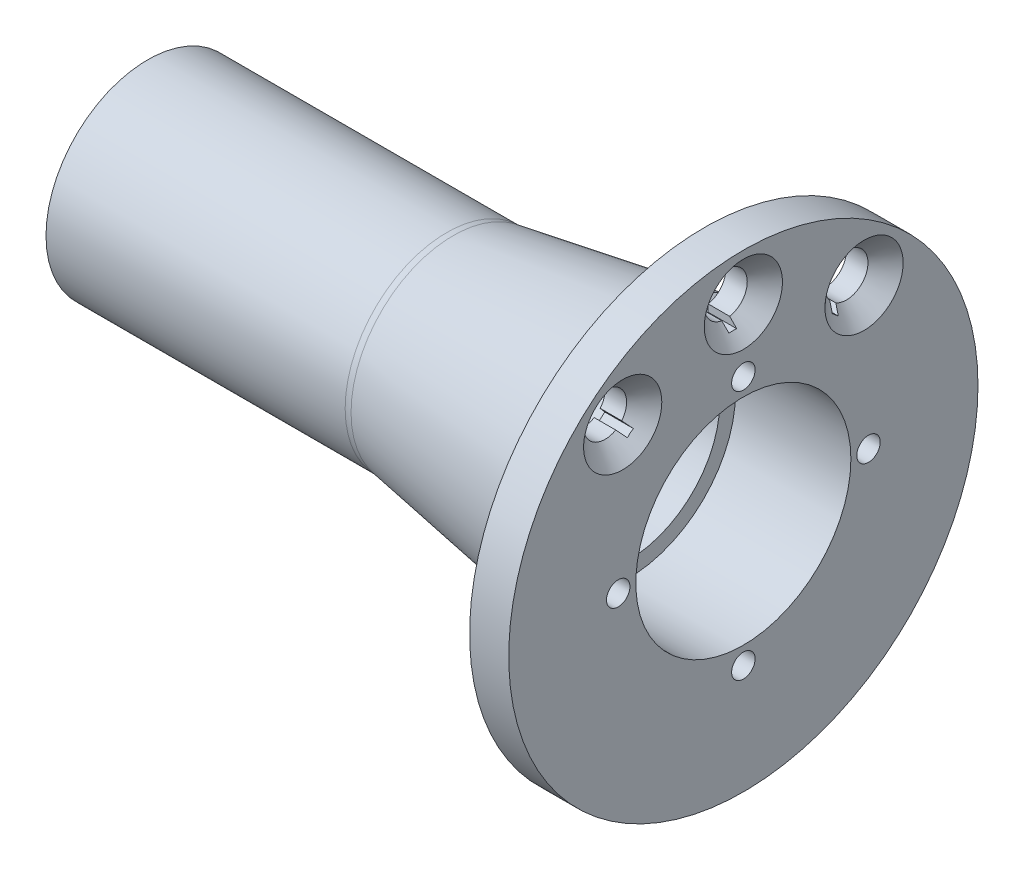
SolidWorks part; units mm, degrees
ref_plane "Face" through (0, 0, 0) normal (0, 0, 1) x (1, 0, 0)
ref_plane "Dessus" through (0, 0, 0) normal (0, 1, 0) x (1, 0, 0)
ref_plane "Droite" through (0, 0, 0) normal (1, 0, 0) x (0, 0, -1)
sketch "Esquisse1" plane through (0, 0, 0) normal (0, 0, 1) x (1, 0, 0)
  line L0 (0, 0) -> (-175.4745, 0) construction
  line L1 (0, 0) -> (0, 60)
  line L2 (0, 60) -> (-10, 60)
  line L3 (-10, 60) -> (-10, 36)
  line L4 (-10, 36) -> (-21, 36)
  line L5 (-21, 36) -> (-21, 35)
  line L6 (-21, 35) -> (-75, 26)
  line L7 (-75, 26) -> (-152.3229, 26)
  line L8 (-152.3229, 26) -> (-152.3229, 0)
  line L9 (-152.3229, 0) -> (0, 0)
  dimension "D1" = 60
  dimension "D2" = 10
  dimension "D3" = 36
  dimension "D4" = 11
  dimension "D5" = 1
  dimension "D6" = 26
  dimension "D7" = 54
revolve "Révolution3" add sketch "Esquisse1" angle 360 about L0
sketch "Esquisse2" plane through (0, 0, 0) normal (0, 0, 1) x (1, 0, 0)
  line L0 (0, 0) -> (0, 27.5)
  line L1 (0, -60) -> (0, 60) construction
  line L2 (0, 27.5) -> (-29.5, 27.5)
  line L3 (-29.5, 27.5) -> (-29.5, 23.5)
  line L4 (-29.5, 23.5) -> (-75, 21)
  line L5 (-75, 21) -> (-152.3229, 21)
  line L6 (-152.3229, 26) -> (-152.3229, -26) construction
  line L7 (-75, 26) -> (-75, -26) construction
  line L8 (0, 0) -> (-159.6226, 0) construction
  line L9 (0, 0) -> (-152.3229, 0)
  line L10 (-152.3229, 0) -> (-152.3229, 21)
  dimension "D1" = 27.5
  dimension "D2" = 29.5
  dimension "D3" = 4
  dimension "D4" = 21
revolve "Enlèvement de matière-Révolution1" cut sketch "Esquisse2" angle 360 about L8
hole_wizard "Trou taraudé M6x1.03" positions "Esquisse4" profile "Esquisse3" tap size "M6x1.0" standard "ISO"
sketch "Esquisse4" plane through (0, 0, 0) normal (1, 0, 0) x (0, 0, -1)
  point P0 (0, 32)
  dimension "D1" = 32
sketch "Esquisse3" plane through (0, 32, 0) normal (0, 1, 0) x (0, 0, -1)
  line L0 (0, 0) -> (0, 16.5022)
  line L1 (0, 16.5022) -> (2.5, 15)
  line L2 (2.5, 15) -> (2.5, 12)
  line L3 (2.5, 12) -> (3, 12)
  line L4 (3, 12) -> (3, 0)
  line L5 (3, 0) -> (0, 0)
  line L10 (0, 16.5022) -> (-2.5, 15) construction
  line L11 (0, -6.35) -> (0, 107.95) construction
  dimension "Diamètre du trou pour taraudage" = 5
  dimension "Profondeur du trou pour taraudage" = 15
  dimension "Diamètre principal du filetage" = 6
  dimension "Profondeur du filetage" = 12
  dimension "Angle de pointe" = 118
hole_wizard "Fraisage pour vis à tête fraisée M101" positions "Esquisse6" profile "Esquisse5" countersink size "M10" standard "ISO"
sketch "Esquisse6" plane through (0, 0, 0) normal (1, 0, 0) x (0, 0, -1)
  line L0 (0, 0) -> (-30.8538, 36.7701) construction
  line L3 (0, 0) -> (0, 68.0368) construction
  point P0 (-30.8538, 36.7701)
  dimension "D1" = 48
  dimension "D2" = 40
sketch "Esquisse5" plane through (0, 36.7701, 30.8538) normal (0, 1, 0) x (0, 0, -1)
  line L0 (0, 0) -> (0, 152.3229)
  line L1 (0, 152.3229) -> (5.5, 152.3229)
  line L2 (5.5, 152.3229) -> (5.5, 4.5)
  line L3 (5.5, 4.5) -> (10, 0)
  line L5 (10, 0) -> (0, 0)
  line L6 (-5.5, 4.5) -> (-10, 0) construction
  line L11 (0, -6.35) -> (0, 107.95) construction
  dimension "Diamètre du perçage jusqu'au prochain" = 11
  dimension "Profondeur du perçage jusqu'au prochain" = 152.3229
  dimension "Diamètre du fraisage entrant" = 20
  dimension "Angle du fraisage entrant" = 90
sketch "Esquisse7" plane through (-10, 0, 0) normal (-1, 0, 0) x (0, 0, 1)
  line L0 (0, 0) -> (30.8538, 36.7701) construction
  line L1 (30.0878, 37.4129) -> (25.4276, 31.8591)
  line L2 (25.4276, 31.8591) -> (26.9596, 30.5735)
  line L3 (26.9596, 30.5735) -> (31.6198, 36.1273)
  line L4 (31.6198, 36.1273) -> (30.0878, 37.4129)
  dimension "D1" = 7.25
  dimension "D2" = 2
extrude "Enlèv. mat.-Extru.1" cut sketch "Esquisse7" against normal through all
pattern_circular "Répétition circulaire1" count 4 over 360 about axis through (0, 0, 0) along (1, 0, 0) of "Trou taraudé M6x1.03"
pattern_circular "Répétition circulaire2" count 3 every 40 about axis through (0, 0, 0) along (1, 0, 0) of "Fraisage pour vis à tête fraisée M101", "Enlèv. mat.-Extru.1"
fillet "Congé1" radius 10 1 edges at (-75, 0, -26)
